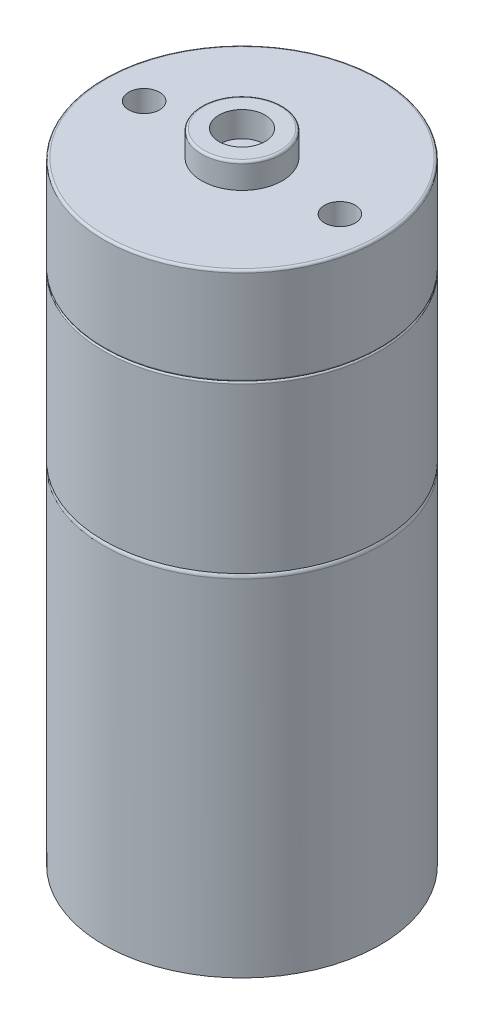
SolidWorks part; units mm, degrees
ref_plane "Front" through (0, 0, 0) normal (0, 0, 1) x (1, 0, 0)
ref_plane "Top" through (0, 0, 0) normal (0, 1, 0) x (1, 0, 0)
ref_plane "Right" through (0, 0, 0) normal (1, 0, 0) x (0, 0, -1)
sketch "스케치1" plane through (0, 0, 0) normal (0, 1, 0) x (1, 0, 0)
  circle A0 centre (0, 0) radius 11.9062
  dimension "D1" = 23.8125
extrude "보스-돌출1" add sketch "스케치1" along normal blind 30.1625
fillet "필렛1" radius 0.3969 1 edges at (0, 30.1625, 11.9062)
ref_plane "평면2" through (0, 30.1625, 0) normal (0, 1, 0) x (1, 0, 0)
sketch "스케치4" plane through (0, 30.1625, 0) normal (0, 1, 0) x (1, 0, 0)
  circle A0 centre (0, 0) radius 11.9062
sketch "스케치7" plane through (0, 0, 0) normal (0, -1, 0) x (1, 0, 0)
  circle A0 centre (0, 0) radius 11.3109
  dimension "D1" = 22.6219
extrude "컷-돌출2" cut sketch "스케치7" against normal blind 0.7937
extrude "보스-돌출2" add sketch "스케치4" along normal blind 14.2875
sketch "스케치8" plane through (0, 44.45, 0) normal (0, 1, 0) x (1, 0, 0)
  circle A0 centre (0, 0) radius 11.9062
fillet "필렛2" radius 0.1488 1 edges at (0, 44.45, 11.9062)
sketch "스케치9" plane through (0, 44.45, 0) normal (0, 1, 0) x (1, 0, 0)
  circle A0 centre (0, 0) radius 11.9062
extrude "보스-돌출4" add sketch "스케치9" along normal blind 8.3344
fillet "필렛3" radius 0.1488 1 edges at (0, 44.45, 11.9062)
fillet "필렛4" radius 0.1984 1 edges at (0, 52.7844, 11.9062)
sketch "스케치10" plane through (0, 52.7844, 0) normal (0, 1, 0) x (1, 0, 0)
  circle A0 centre (0, 0) radius 3.4727
  dimension "D1" = 6.9453
extrude "보스-돌출5" add sketch "스케치10" along normal blind 2.1828
fillet "필렛5" radius 0.1984 1 edges at (0, 54.9672, 3.4727)
sketch "스케치11" plane through (0, 54.9672, 0) normal (0, 1, 0) x (1, 0, 0)
  circle A0 centre (0, 0) radius 1.9844
  dimension "D1" = 3.9688
extrude "컷-돌출3" cut sketch "스케치11" against normal blind 2.1828
sketch "스케치12" plane through (0, 52.7844, 0) normal (0, 1, 0) x (1, 0, 0)
  line L0 (19.116, 0) -> (-15.9287, 0) construction
  circle A0 centre (8.4328, 0) radius 1.3271
  circle A1 centre (-8.4328, 0) radius 1.3271
  dimension "D1" = 8.4328
  dimension "D3" = 2.6543
  dimension "D4" = 2.6543
  dimension "D2" = 8.4328
extrude "컷-돌출4" cut sketch "스케치12" against normal blind 5.08
sketch "스케치13" plane through (0, 0, 0) normal (0, 0, 1) x (1, 0, 0)
  line L0 (0, -12.1814) -> (0, 57.4382) construction
  line L1 (4.9609, 29.3687) -> (7.3422, 29.3687)
  line L2 (4.9609, 29.3687) -> (4.9609, 28.3766)
  line L3 (4.9609, 28.3766) -> (7.3422, 28.3766)
  line L4 (7.3422, 29.3687) -> (7.3422, 28.3766)
  line L5 (55, 30.1625) -> (-55, 30.1625) construction
  line L6 (-4.9609, 29.3687) -> (-4.9609, 28.3766)
  line L7 (-4.9609, 29.3687) -> (-7.3422, 29.3687)
  line L8 (-7.3422, 29.3687) -> (-7.3422, 28.3766)
  line L9 (-4.9609, 28.3766) -> (-7.3422, 28.3766)
  dimension "D1" = 0.9922
  dimension "D2" = 0.7937
  dimension "D3" = 2.3813
  dimension "D4" = 4.9609
